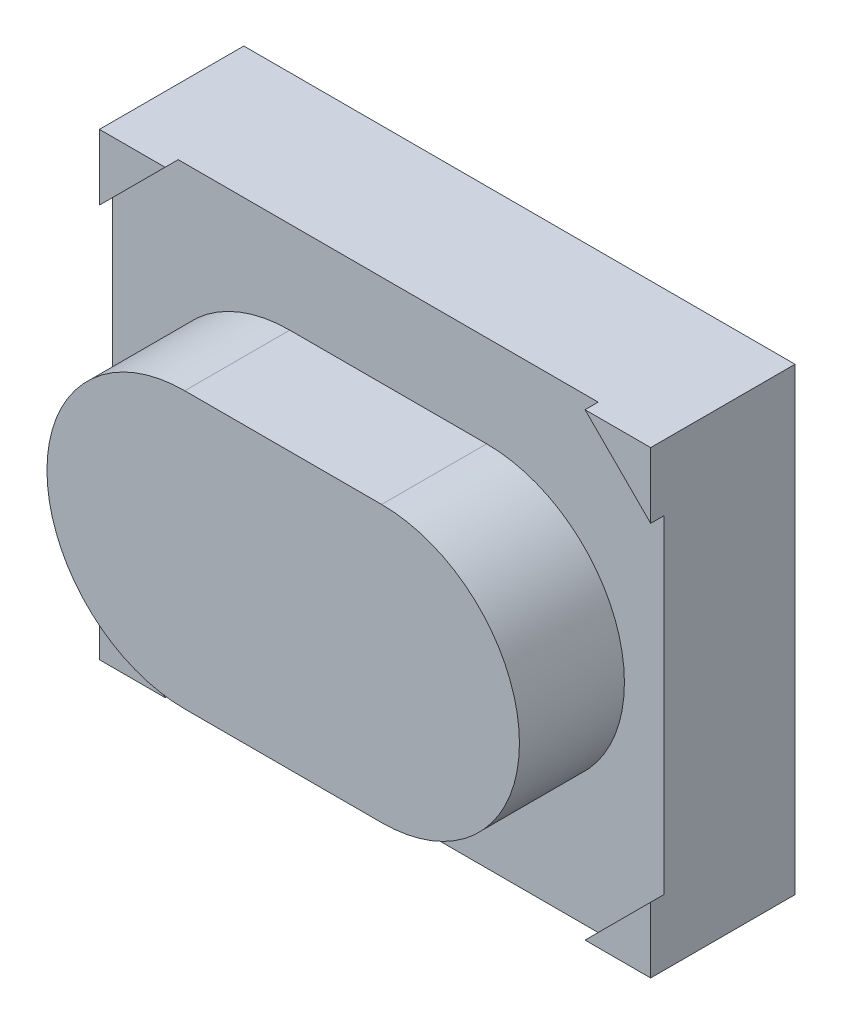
SolidWorks part; units mm, degrees
ref_plane "前视基准面" through (0, 0, 0) normal (0, 0, 1) x (1, 0, 0)
ref_plane "上视基准面" through (0, 0, 0) normal (0, 1, 0) x (1, 0, 0)
ref_plane "右视基准面" through (0, 0, 0) normal (1, 0, 0) x (0, 0, -1)
sketch "草图1" plane through (0, 0, 0) normal (0, 0, 1) x (1, 0, 0)
  line L1 (2.1, -1.75) -> (-2.1, -1.75)
  line L2 (2.1, -1.75) -> (2.1, 1.75)
  line L3 (2.1, 1.75) -> (-2.1, 1.75)
  line L4 (-2.1, -1.75) -> (-2.1, 1.75)
  line L5 (2.1, -1.75) -> (-2.1, 1.75) construction
  line L6 (2.1, 1.75) -> (-2.1, -1.75) construction
  point P0 (0, 0)
  dimension "D1" = 3.5
  dimension "D2" = 4.2
extrude "凸台-拉伸1" add sketch "草图1" along normal blind 1
sketch "草图2" plane through (0, 0, 1) normal (0, 0, 1) x (1, 0, 0)
  line L0 (0, 2.563) -> (0, -2.8485) construction
  line L1 (-4.7772, 0) -> (2.9487, 0) construction
  line L2 (-2.1, 1.25) -> (-2.1, 1.75)
  line L3 (-2.1, 1.75) -> (-2.1, -1.75) construction
  line L4 (-2.1, 1.75) -> (-1.6, 1.75)
  line L5 (2.1, 1.75) -> (-2.1, 1.75) construction
  line L6 (-1.6, 1.75) -> (-2.1, 1.25)
  line L7 (1.6, 1.75) -> (2.1, 1.25)
  line L8 (2.1, 1.75) -> (1.6, 1.75)
  line L9 (2.1, 1.25) -> (2.1, 1.75)
  line L10 (2.1, -1.25) -> (2.1, -1.75)
  line L11 (2.1, -1.75) -> (1.6, -1.75)
  line L12 (1.6, -1.75) -> (2.1, -1.25)
  line L13 (-1.6, -1.75) -> (-2.1, -1.25)
  line L14 (-2.1, -1.75) -> (-1.6, -1.75)
  line L15 (-2.1, -1.25) -> (-2.1, -1.75)
  dimension "D1" = 0.5
  dimension "D2" = 0.5
extrude "凸台-拉伸2" add sketch "草图2" along normal blind 0.1
sketch "草图3" plane through (0, 0, 1) normal (0, 0, 1) x (1, 0, 0)
  line L0 (-0.75, 0) -> (0.75, 0) construction
  line L1 (-0.75, 1.05) -> (0.75, 1.05)
  line L2 (-0.75, -1.05) -> (0.75, -1.05)
  arc A0 (-0.75, 1.05) -> (-0.75, -1.05) centre (-0.75, 0) ccw
  arc A1 (0.75, -1.05) -> (0.75, 1.05) centre (0.75, 0) ccw
  point P2 (0, 0)
  dimension "D1" = 1.05
  dimension "D2" = 1.5
extrude "凸台-拉伸3" add sketch "草图3" along normal blind 0.8
